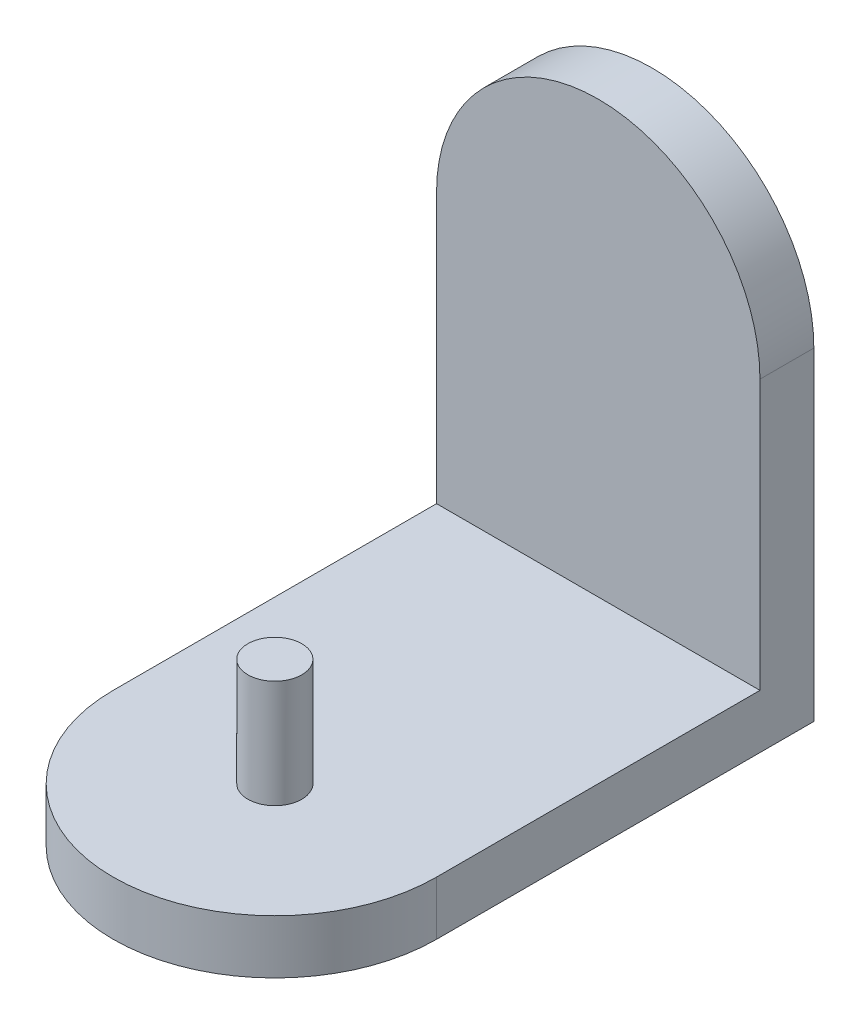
SolidWorks part; units mm, degrees
ref_plane "前视基准面" through (0, 0, 0) normal (0, 0, 1) x (1, 0, 0)
ref_plane "上视基准面" through (0, 0, 0) normal (0, 1, 0) x (1, 0, 0)
ref_plane "右视基准面" through (0, 0, 0) normal (1, 0, 0) x (0, 0, -1)
other "Configuration Table"
sketch "草图1" plane through (0, 0, 0) normal (0, 0, 1) x (1, 0, 0)
  line L0 (0, 0) -> (0, 24.7277) construction
  line L2 (-15, 15) -> (-15, -15)
  line L3 (-15, -15) -> (15, -15)
  line L4 (15, 15) -> (15, -15)
  line L5 (-15, 15) -> (15, -15) construction
  line L6 (-15, -15) -> (15, 15) construction
  arc A0 (15, 15) -> (-15, 15) centre (0, 15) ccw
  point P0 (0, 0)
  dimension "D1" = 30
  dimension "D2" = 30
extrude "凸台-拉伸1" add sketch "草图1" along normal blind 5
sketch "草图2" plane through (0, 0, 5) normal (0, 0, 1) x (1, 0, 0)
  line L0 (0, 0) -> (0, -27.8012) construction
  line L1 (15, -15) -> (15, 15) construction
  line L2 (-15, -10) -> (15, -10)
  line L3 (-15, -10) -> (-15, -15)
  line L4 (-15, -15) -> (15, -15)
  line L5 (15, -10) -> (15, -15)
  line L6 (-15, -10) -> (15, -15) construction
  line L7 (-15, -15) -> (15, -10) construction
  line L8 (-15, -15) -> (15, -15) construction
  point P3 (0, -12.5)
  dimension "D1" = 5
extrude "凸台-拉伸2" add sketch "草图2" along normal blind 30
sketch "草图3" plane through (0, -10, 0) normal (0, 1, 0) x (1, 0, 0)
  line L1 (15, -35) -> (-15, -35) construction
  line L2 (-15, -35) -> (15, -35) construction
  line L3 (15, -35) -> (-15, -35)
  arc A1 (-15, -35) -> (15, -35) centre (0, -35) ccw
extrude "凸台-拉伸3" add sketch "草图3" against normal up to surface (5 mm away)
sketch "草图5" plane through (0, -10, 0) normal (0, 1, 0) x (1, 0, 0)
  circle A0 centre (0, -35) radius 2.5
  dimension "D1" = 5
extrude "凸台-拉伸4" add sketch "草图5" along normal blind 10
